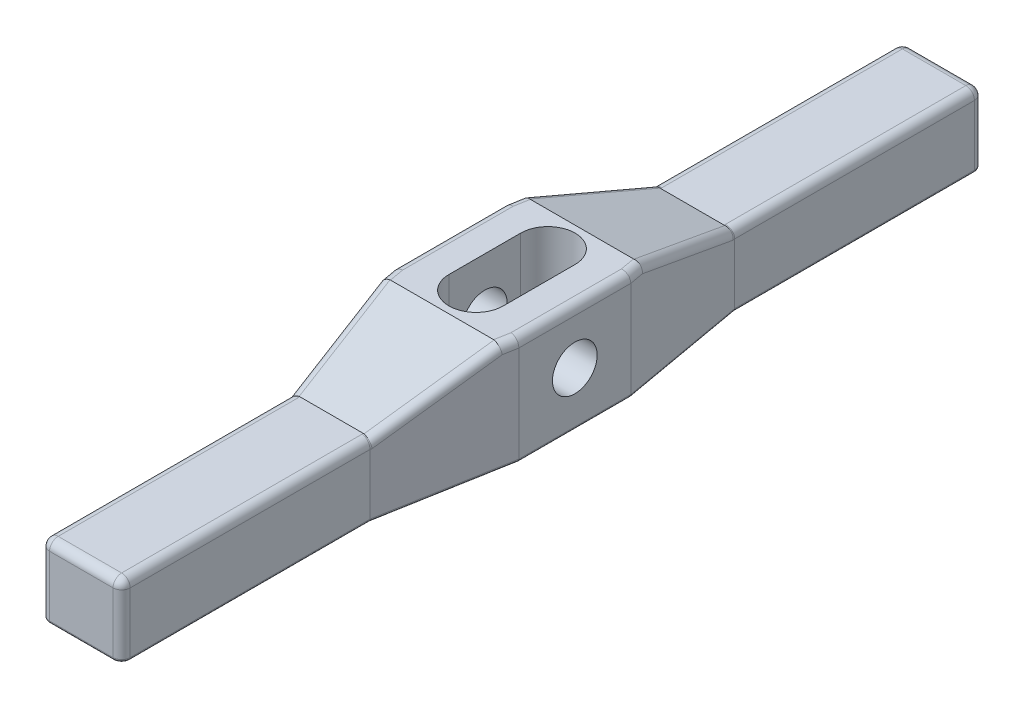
SolidWorks part; units mm, degrees
ref_plane "Front Plane" through (0, 0, 0) normal (0, 0, 1) x (1, 0, 0)
ref_plane "Top Plane" through (0, 0, 0) normal (0, 1, 0) x (1, 0, 0)
ref_plane "Right Plane" through (0, 0, 0) normal (1, 0, 0) x (0, 0, -1)
sketch "Sketch1" plane through (0, 0, 0) normal (0, 1, 0) x (1, 0, 0)
  line L0 (0, 0) -> (68.8474, 0) construction
  line L1 (0, 0) -> (0, 75.643) construction
  line L2 (-7.1374, 76.2) -> (7.1374, 76.2)
  line L3 (7.1374, 76.2) -> (7.1374, 32.258)
  line L4 (7.1374, 32.258) -> (11.1125, 9.903)
  line L5 (11.1125, 9.903) -> (11.1125, -9.903)
  line L6 (7.1374, -32.258) -> (11.1125, -9.903)
  line L7 (7.1374, -76.2) -> (7.1374, -32.258)
  line L8 (-7.1374, -76.2) -> (7.1374, -76.2)
  line L9 (-7.1374, -76.2) -> (-7.1374, -32.258)
  line L10 (-7.1374, -32.258) -> (-11.1125, -9.903)
  line L11 (-11.1125, 9.903) -> (-11.1125, -9.903)
  line L12 (-7.1374, 32.258) -> (-11.1125, 9.903)
  line L13 (-7.1374, 76.2) -> (-7.1374, 32.258)
  line L14 (-4.8133, 6.35) -> (-4.8133, -6.35)
  line L15 (4.8133, 6.35) -> (4.8133, -6.35)
  arc A0 (4.8133, 6.35) -> (-4.8133, 6.35) centre (0, 6.35) ccw
  arc A1 (-4.8133, -6.35) -> (4.8133, -6.35) centre (0, -6.35) ccw
  dimension "D1" = 14.2748
  dimension "D2" = 152.4
  dimension "D3" = 22.225
  dimension "D4" = 43.942
  dimension "D5" = 19.8059
  dimension "D6" = 12.7
  dimension "D7" = 9.6266
extrude "Extrude1" add sketch "Sketch1" along normal blind 19.05
sketch "Sketch2" plane through (11.1125, 0, 0) normal (1, 0, 0) x (0, 0, -1)
  line L0 (0, 0) -> (0, 25.2428) construction
  line L1 (-9.903, 0) -> (9.903, 0) construction
  line L2 (76.2, 19.05) -> (12.3698, 19.05)
  line L3 (9.903, 19.05) -> (32.258, 19.05) construction
  line L4 (12.3698, 19.05) -> (31.9131, 12.7)
  line L5 (31.9131, 12.7) -> (76.2, 12.7)
  line L6 (76.2, 19.05) -> (76.2, 0) construction
  line L7 (76.2, 12.7) -> (76.2, 19.05)
  line L8 (32.258, 0) -> (76.2, 0) construction
  line L9 (-76.2, 12.7) -> (-76.2, 19.05)
  line L10 (-31.9131, 12.7) -> (-76.2, 12.7)
  line L11 (-12.3698, 19.05) -> (-31.9131, 12.7)
  line L12 (-76.2, 19.05) -> (-12.3698, 19.05)
  dimension "D1" = 12.3698
  dimension "D2" = 18
  dimension "D3" = 12.7
extrude "Cut-Extrude1" cut sketch "Sketch2" against normal through all
sketch "Sketch3" plane through (11.1125, 0, 0) normal (1, 0, 0) x (0, 0, -1)
  line L0 (-9.903, 0) -> (9.903, 0) construction
  circle A0 centre (0, 9.525) radius 3.956
  dimension "D1" = 7.9121
  dimension "D2" = 9.525
extrude "Cut-Extrude2" cut sketch "Sketch3" against normal through all
fillet "Fillet1" radius 1.524 4 edges at (-7.1374, 6.35, -76.2) (7.1374, 6.35, -76.2) (7.1374, 6.35, 76.2) (-7.1374, 6.35, 76.2)
fillet "Fillet2" radius 0.508 16 edges at (-7.1374, 0, 53.467) (-6.691, 0, 75.7536) (0, 0, 76.2) (6.691, 0, 75.7536) (-7.1374, 0, -53.467) (-6.691, 0, -75.7536) (0, 0, -76.2) (6.691, 0, -75.7536) (-9.125, 0, -21.0805) (-11.1125, 0, 0) (-9.125, 0, 21.0805) (7.1374, 0, 53.467) (9.125, 0, 21.0805) (11.1125, 0, 0) (9.125, 0, -21.0805) (7.1374, 0, -53.467)
fillet "Fillet3" radius 1.524 24 edges at (-6.691, 12.7, 75.7536) (0, 12.7, 76.2) (6.691, 12.7, 75.7536) (-7.1374, 12.7, -53.467) (-6.691, 12.7, -75.7536) (0, 12.7, -76.2) (6.691, 12.7, -75.7536) (-7.1681, 12.7, -32.0855) (-8.9363, 15.875, -22.1414) (-10.8932, 19.05, -11.1364) (-10.8932, 19.05, 11.1364) (-11.1125, 19.05, 0) (-8.9363, 15.875, 22.1414) (-7.1374, 12.7, 53.467) (-7.1681, 12.7, 32.0855) (7.1374, 12.7, 53.467) (7.1681, 12.7, 32.0855) (8.9363, 15.875, 22.1414) (10.8932, 19.05, 11.1364) (11.1125, 19.05, 0) (10.8932, 19.05, -11.1364) (7.1681, 12.7, -32.0855) (8.9363, 15.875, -22.1414) (7.1374, 12.7, -53.467)
